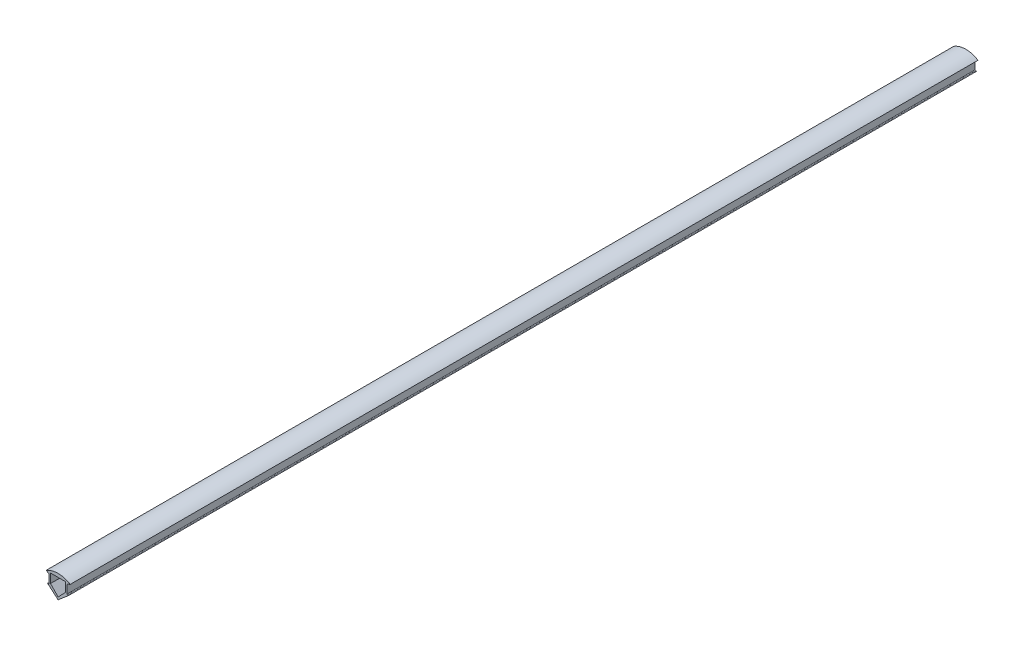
SolidWorks part; units mm, degrees
ref_plane "前视基准面" through (0, 0, 0) normal (0, 0, 1) x (1, 0, 0)
ref_plane "上视基准面" through (0, 0, 0) normal (0, 1, 0) x (1, 0, 0)
ref_plane "右视基准面" through (0, 0, 0) normal (1, 0, 0) x (0, 0, -1)
sketch "草图1" plane through (0, 0, 0) normal (0, 0, 1) x (1, 0, 0)
  line L0 (-2.5, 0.4251) -> (0, -2.2004)
  line L3 (0, -3) -> (-3.5, 0)
  line L4 (-3.5, 0) -> (-3.2, 0)
  line L5 (0, -3) -> (3.5, 0)
  line L6 (-3, 0.2) -> (-3, 2.8677)
  line L8 (-2.5, 3.4251) -> (2.5, 3.4251)
  line L10 (3.5, 0) -> (3.2, 0)
  line L11 (3, 0.2) -> (3, 2.8677)
  line L12 (4, 3.4251) -> (3.1218, 3.0518)
  line L13 (-4, 3.4251) -> (-3.1218, 3.0518)
  line L15 (2.5, 3.4251) -> (2.5, 0.4251)
  line L16 (-2.5, 3.4251) -> (-2.5, 0.4251)
  line L17 (0, -2.2004) -> (2.5, 0.4251)
  arc A0 (-3.2, 0) -> (-3, 0.2) centre (-3.2, 0.2) ccw
  arc A1 (4, 3.4251) -> (-4, 3.4251) centre (0, -3) ccw
  arc A2 (3.2, 0) -> (3, 0.2) centre (3.2, 0.2) cw
  arc A3 (3, 2.8677) -> (3.1218, 3.0518) centre (3.2, 2.8677) cw
  arc A4 (-3, 2.8677) -> (-3.1218, 3.0518) centre (-3.2, 2.8677) ccw
  point P17 (0, 3.4251)
  point P22 (-3, 0)
  dimension "D2" = 0.2
  dimension "D3" = 0.2
  dimension "D4" = 0.2
  dimension "D1" = 3
extrude "凸台-拉伸1" add sketch "草图1" along normal mid plane 300
